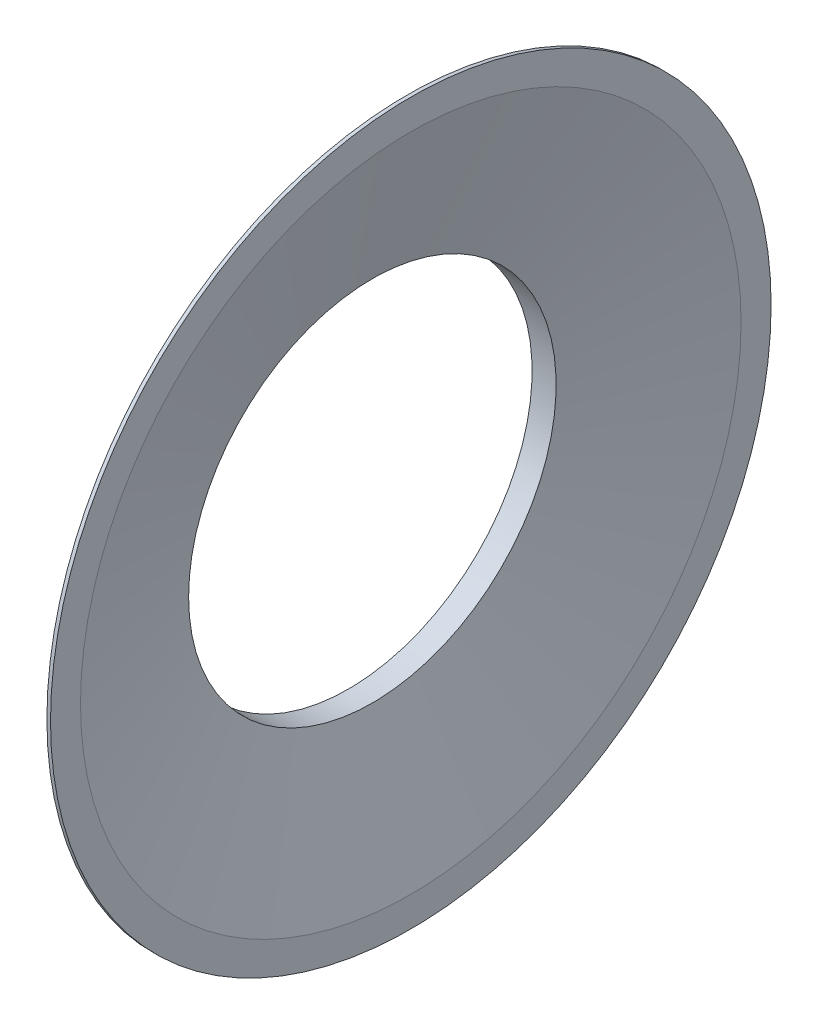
SolidWorks part; units mm, degrees
ref_plane "Спереди" through (0, 0, 0) normal (0, 0, 1) x (1, 0, 0)
ref_plane "Сверху" through (0, 0, 0) normal (0, 1, 0) x (1, 0, 0)
ref_plane "Справа" through (0, 0, 0) normal (1, 0, 0) x (0, 0, -1)
sketch "Эскиз1" plane through (0, 0, 0) normal (0, 0, 1) x (1, 0, 0)
  line L0 (0, 0) -> (26.3969, 0) construction
  line L1 (0, 30.6) -> (0, 31.2)
  line L2 (10.4, 55) -> (4, 30.6)
  line L3 (4, 30.6) -> (0, 30.6)
  line L4 (0, 31.2) -> (3.4, 31.2)
  line L5 (3.4, 31.2) -> (9.8, 55)
  line L6 (10.4, 55) -> (10.4, 60)
  line L7 (9.8, 55) -> (9.8, 60)
  line L8 (9.8, 60) -> (10.4, 60)
  dimension "D1" = 4
  dimension "D2" = 30.6
  dimension "D3" = 0.6
  dimension "D4" = 60
  dimension "D5" = 55
  dimension "D6" = 0.6
  dimension "D7" = 0.6
  dimension "D8" = 6.4
revolve "Повернуть1" add sketch "Эскиз1" angle 360 about L0
